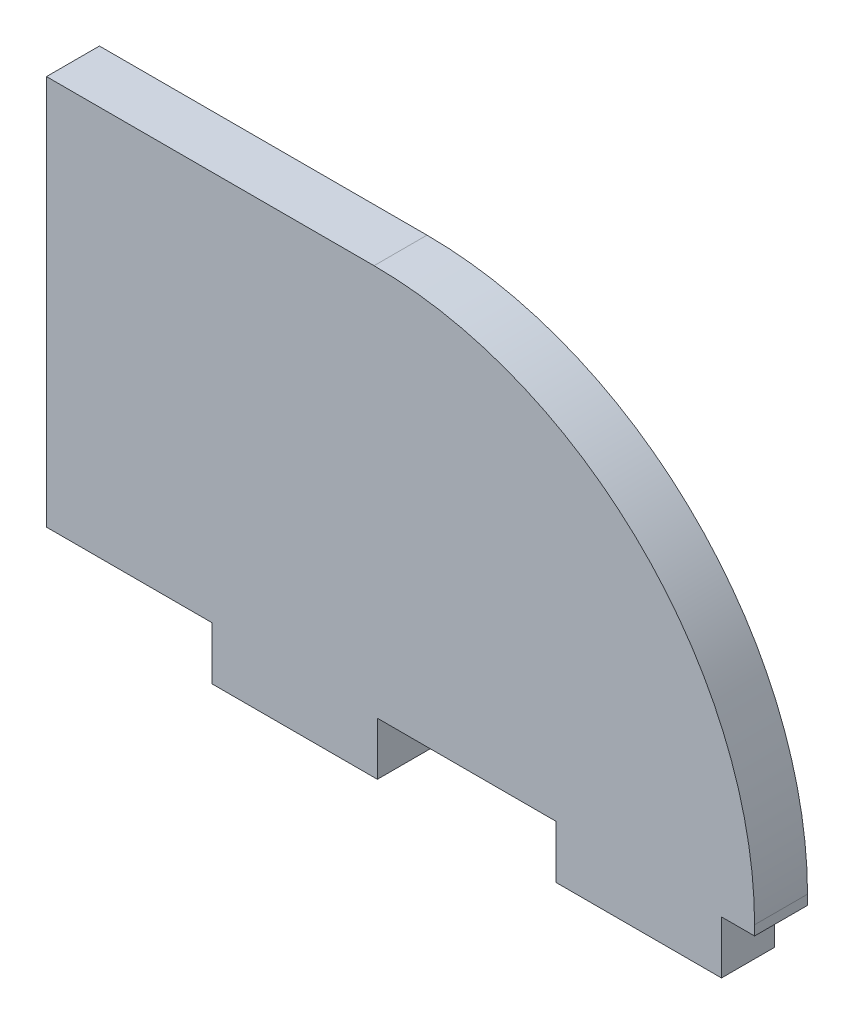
SolidWorks part; units mm, degrees
ref_plane "Front Plane" through (0, 0, 0) normal (0, 0, 1) x (1, 0, 0)
ref_plane "Top Plane" through (0, 0, 0) normal (0, 1, 0) x (1, 0, 0)
ref_plane "Right Plane" through (0, 0, 0) normal (1, 0, 0) x (0, 0, -1)
sketch "Sketch1" plane through (0, 0, 0) normal (0, 0, 1) x (1, 0, 0)
  line L0 (50, 0) -> (50, 16)
  line L1 (50, 0) -> (100, 0)
  line L2 (0, 0) -> (0, 133.933)
  line L3 (0, 133.933) -> (214, 133.933)
  line L5 (154, 0) -> (204, 0)
  line L6 (254, 66.9665) -> (214, 66.9665) construction
  line L8 (214, 16) -> (204, 16)
  line L9 (0, 16) -> (50, 16)
  line L10 (0, 0) -> (0, 16)
  line L11 (214, 133.933) -> (214, 16)
  line L14 (204, 0) -> (204, 16)
  line L16 (100, 0) -> (100, 16)
  line L17 (100, 16) -> (154, 16)
  line L18 (154, 0) -> (154, 16)
extrude "Boss-Extrude1" add sketch "Sketch1" along normal blind 16
fillet "Fillet1" radius 115 1 edges at (214, 133.933, 8)
equation "\"thk\"= 16mm"
equation "\"D1@Boss-Extrude1\"=\"thk\""
equation "\"D4@Sketch1\"=\"thk\""
equation "\"D1@Sketch1\"=\"thk\""
